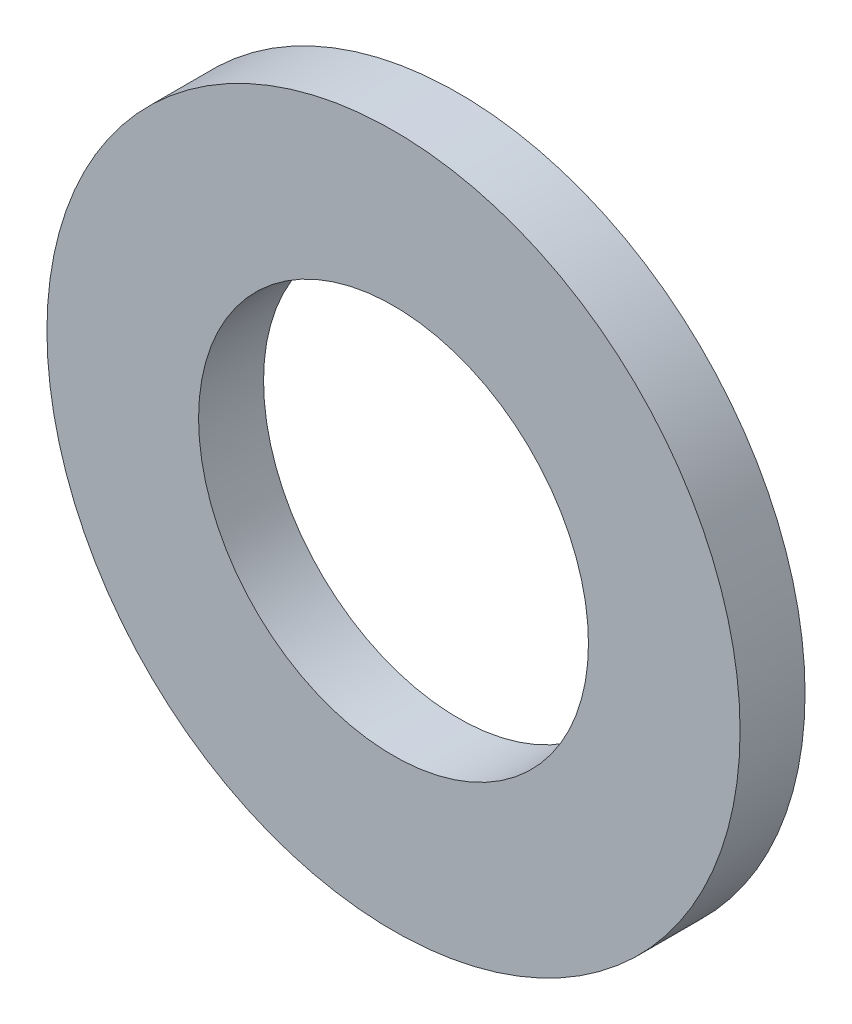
SolidWorks part; units mm, degrees
ref_plane "face" through (0, 0, 0) normal (0, 0, 1) x (1, 0, 0)
ref_plane "dessus" through (0, 0, 0) normal (0, 1, 0) x (1, 0, 0)
ref_plane "profil" through (0, 0, 0) normal (1, 0, 0) x (0, 0, -1)
sketch "Esquisse1" plane through (0, 0, 0) normal (0, 0, 1) x (1, 0, 0)
  circle A0 centre (0, 0) radius 16
  dimension "D1" = 32
extrude "Base-Extrusion" add sketch "Esquisse1" against normal blind 3
sketch "Esquisse2" plane through (0, 0, 0) normal (0, 0, 1) x (1, 0, 0)
  circle A0 centre (0, 0) radius 9
  dimension "D1" = 18
extrude "Enlèv. mat.-Extru.1" cut sketch "Esquisse2" against normal blind 3
